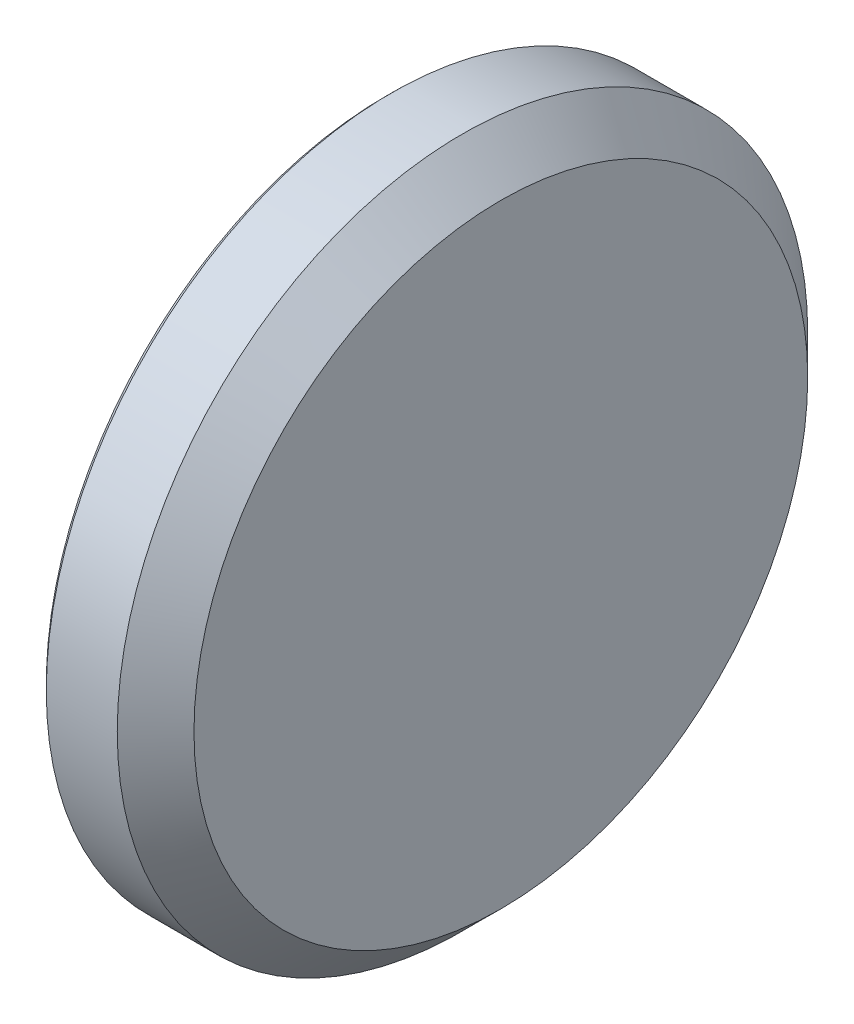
SolidWorks part; units mm, degrees
ref_plane "Спереди" through (0, 0, 0) normal (0, 0, 1) x (1, 0, 0)
ref_plane "Сверху" through (0, 0, 0) normal (0, 1, 0) x (1, 0, 0)
ref_plane "Справа" through (0, 0, 0) normal (1, 0, 0) x (0, 0, -1)
sketch "Эскиз1" plane through (0, 0, 0) normal (1, 0, 0) x (0, 0, -1)
  circle A0 centre (0, 0) radius 9
  dimension "D1" = 18
extrude "Бобышка-Вытянуть1" add sketch "Эскиз1" along normal blind 3
chamfer "Фаска1" distance 1 angle 45 1 edges at (3, 0, -9)
chamfer "Фаска2" distance 0.15 angle 45 1 edges at (0, 0, -9)
